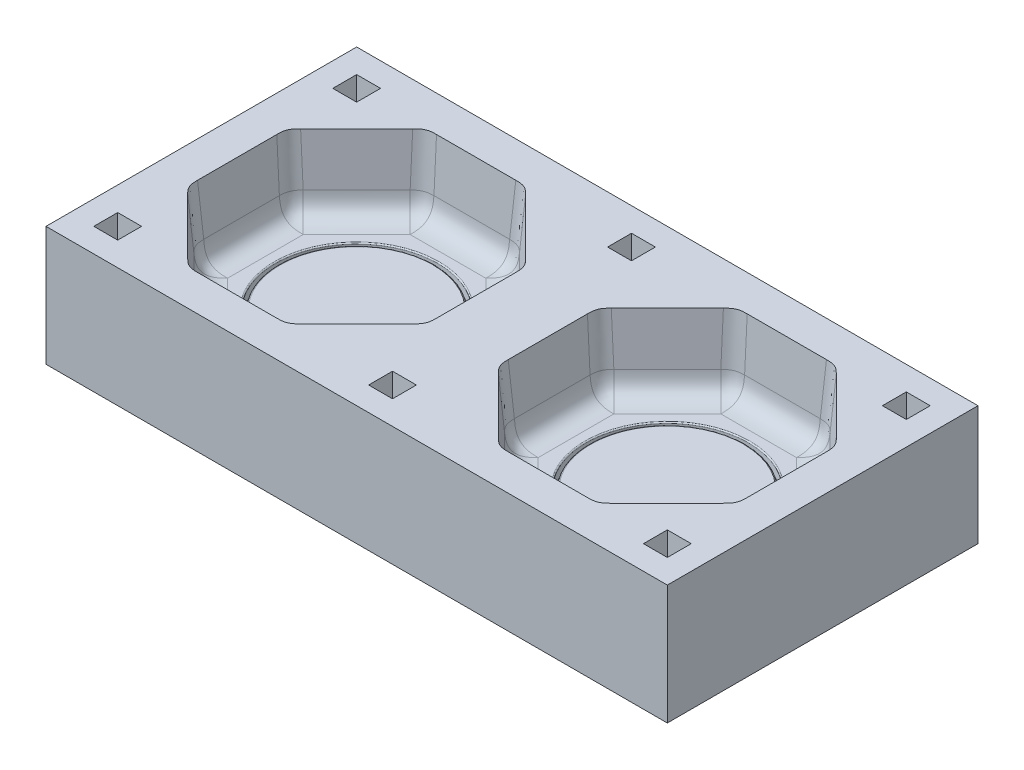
SolidWorks part; units mm, degrees
ref_plane "Front Plane" through (0, 0, 0) normal (0, 0, 1) x (1, 0, 0)
ref_plane "Top Plane" through (0, 0, 0) normal (0, 1, 0) x (1, 0, 0)
ref_plane "Right Plane" through (0, 0, 0) normal (1, 0, 0) x (0, 0, -1)
imported_body "SingleCavity"
sketch "Sketch1" plane through (0, -34, 0) normal (0, -1, 0) x (1, 0, 0)
  line L0 (0, 0) -> (130, 0) construction
  circle A1 centre (0, 0) radius 32.0172 construction
  circle A3 centre (130, 0) radius 32.0172 construction
  circle A4 centre (0, 0) radius 1.5
  circle A5 centre (130, 0) radius 1.5
  dimension "D2" = 3
  dimension "D3" = 64.0343
  dimension "D1" = 130
sketch "Sketch2" plane through (0, 0, 0) normal (0, -1, 0) x (1, 0, 0)
  line L0 (-65, 0) -> (65, 0) construction
  line L8 (-65, -65) -> (65, -65)
  line L9 (65, -65) -> (65, 65)
  line L10 (65, 65) -> (-65, 65)
  line L11 (-65, 65) -> (-65, -65)
  dimension "D1" = 130
  dimension "D2" = 130
  dimension "D3" = 65
extrude "Boss-Extrude1" add sketch "Sketch2" along normal blind 50 separate body
combine bodies "Combine1" operation type subtract main body 104 bodies to subtract 101
mirror "Mirror1" about plane through (65, -50, -65) normal (-1, 0, 0)
sketch "Sketch5" plane through (0, 0, 0) normal (0, 1, 0) x (1, 0, 0)
  line L1 (-55, 55) -> (185, 55) construction
  line L2 (-55, 55) -> (-55, -55) construction
  line L3 (-55, -55) -> (185, -55) construction
  line L4 (185, 55) -> (185, -55) construction
  line L7 (-65, 65) -> (195, 65) construction
  line L8 (65, 55) -> (65, -55) construction
  line L9 (-55, 55) -> (-45, 55)
  line L10 (-55, 55) -> (-55, 45)
  line L11 (-55, 45) -> (-45, 45)
  line L12 (-45, 55) -> (-45, 45)
  line L13 (185, 55) -> (175, 55)
  line L14 (185, 55) -> (185, 45)
  line L15 (185, 45) -> (175, 45)
  line L16 (175, 55) -> (175, 45)
  line L17 (60, 55) -> (70, 55)
  line L18 (60, 55) -> (60, 45)
  line L19 (60, 45) -> (70, 45)
  line L20 (70, 55) -> (70, 45)
  line L21 (70, -55) -> (60, -55)
  line L22 (70, -55) -> (70, -45)
  line L23 (70, -45) -> (60, -45)
  line L24 (60, -55) -> (60, -45)
  line L25 (-55, -55) -> (-45, -55)
  line L26 (-55, -55) -> (-55, -45)
  line L27 (-55, -45) -> (-45, -45)
  line L28 (-45, -55) -> (-45, -45)
  line L29 (185, -55) -> (175, -55)
  line L30 (185, -55) -> (185, -45)
  line L31 (185, -45) -> (175, -45)
  line L32 (175, -55) -> (175, -45)
  line L34 (195, -65) -> (-65, -65) construction
  line L35 (195, -65) -> (195, 65) construction
  line L36 (-65, -65) -> (-65, 65) construction
  point P32 (65, -45)
  point P35 (65, 55)
  dimension "D1" = 10
  dimension "D2" = 10
  dimension "D3" = 10
  dimension "D4" = 10
  dimension "D5" = 10
  dimension "D6" = 10
extrude "Cut-Extrude1" cut sketch "Sketch5" against normal blind 10 draft 3
